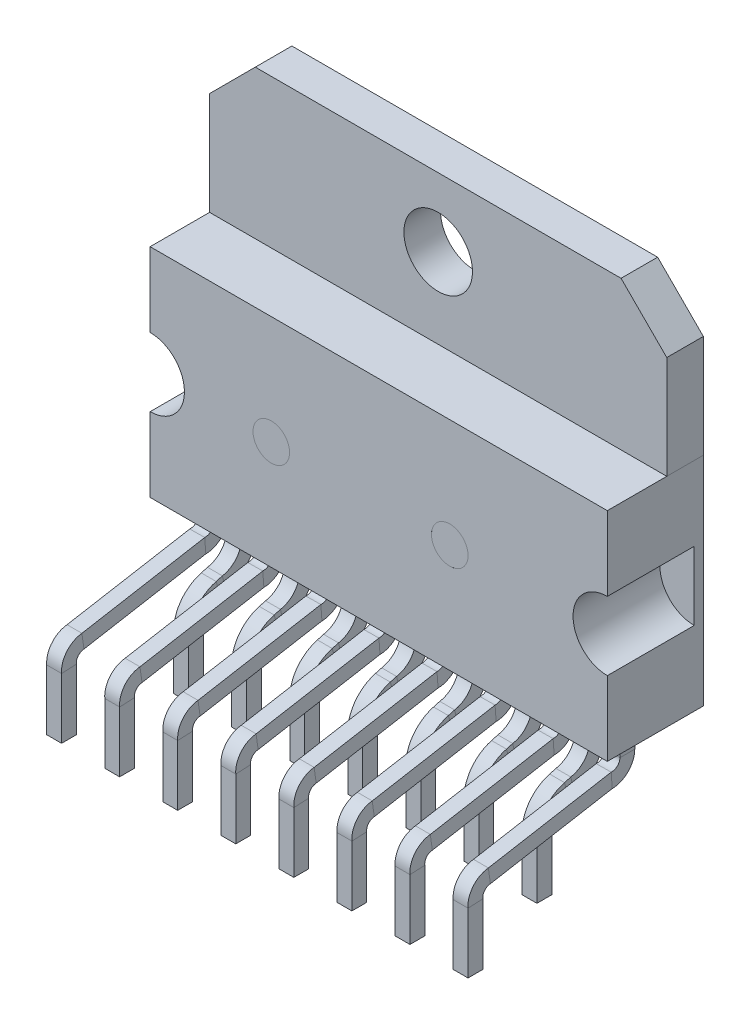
SolidWorks part; units mm, degrees
ref_plane "Front Plane" through (0, 0, 0) normal (0, 0, 1) x (1, 0, 0)
ref_plane "Top Plane" through (0, 0, 0) normal (0, 1, 0) x (1, 0, 0)
ref_plane "Right Plane" through (0, 0, 0) normal (1, 0, 0) x (0, 0, -1)
sketch "Sketch2" plane through (0, 0, 0) normal (0, 0, 1) x (1, 0, 0)
  line L0 (-9.2035, 0) -> (10.7965, 0)
  line L1 (10.7965, 0) -> (10.7965, 4.5)
  line L2 (10.7965, 4.5) -> (8.7965, 6.5022)
  line L3 (8.7965, 6.5022) -> (-7.2035, 6.5022)
  line L4 (-7.2035, 6.5022) -> (-9.2035, 4.5)
  line L5 (-9.2035, 4.5) -> (-9.2035, 0)
  line L6 (-9.2035, 0) -> (-9.2035, -9.5)
  line L7 (-9.2035, -9.5) -> (10.7965, -9.5)
  line L8 (10.7965, -9.5) -> (10.7965, 0)
  circle A0 centre (0.7965, 3.5022) radius 1.5
  dimension "D7" = 3
  dimension "D8" = 3
  dimension "D1" = 20
  dimension "D2" = 4.5
  dimension "D3" = 4.5
  dimension "D4" = 16
  dimension "D5" = 2.83
  dimension "D6" = 2.83
  dimension "D9" = 9.5
extrude "Boss-Extrude1" add sketch "Sketch2" along normal blind 1.6 contours L4 L5 L0 L1 L2 L3 A0 | L7 L8 L0 L6
sketch "Sketch3" plane through (0, 0, 1.6) normal (0, 0, 1) x (1, 0, 0)
  line L0 (-9.2035, -9.5) -> (-9.2035, 0)
  line L1 (-9.2035, 4.5) -> (-9.2035, -9.5) construction
  line L2 (-9.2035, 0) -> (10.7965, 0)
  line L3 (10.7965, -9.5) -> (10.7965, 4.5) construction
  line L4 (10.7965, 0) -> (10.7965, -9.5)
  line L5 (10.7965, -9.5) -> (-9.2035, -9.5)
  dimension "D1" = 9.5
extrude "Boss-Extrude3" add sketch "Sketch3" along normal blind 2.6
ref_plane "Plane2" through (-8.5335, 0, 0) normal (-1, 0, 0) x (0, 0, 1)
sketch "Sketch5" plane through (-8.5335, 0, 0) normal (-1, 0, 0) x (0, 0, 1)
  line L0 (2.1, -9.5) -> (2.1, -10.86)
  line L1 (4.2, -9.5) -> (0, -9.5) construction
  line L2 (2.7864, -11.54) -> (8.1344, -12.48)
  line L3 (8.7448, -13.2231) -> (8.7448, -14.5831)
  arc A0 (2.1, -10.86) -> (2.7864, -11.54) centre (2.78, -10.86) ccw
  arc A1 (8.1344, -12.48) -> (8.7448, -13.2231) centre (8.0681, -13.1567) cw
  dimension "D2" = 0.68
  dimension "D5" = 0.68
  dimension "D1" = 1.36
  dimension "D3" = 5.43
  dimension "D4" = 0.94
  dimension "D6" = 1.36
ref_plane "Plane3" through (0, -14.5831, 0) normal (0, 1, 0) x (1, 0, 0)
sketch "Sketch6" plane through (0, -14.5831, 0) normal (0, 1, 0) x (1, 0, 0)
  line L1 (-8.8585, -8.4198) -> (-8.2085, -8.4198)
  line L2 (-8.8585, -8.4198) -> (-8.8585, -9.0698)
  line L3 (-8.8585, -9.0698) -> (-8.2085, -9.0698)
  line L4 (-8.2085, -8.4198) -> (-8.2085, -9.0698)
  line L5 (-8.8585, -8.4198) -> (-8.2085, -9.0698) construction
  line L6 (-8.8585, -9.0698) -> (-8.2085, -8.4198) construction
  point P0 (-8.5335, -8.7448)
  dimension "D1" = 0.65
  dimension "D2" = 0.65
sweep "Sweep1" add profiles "Sketch6" path "Sketch5"
pattern_linear "LPattern1" count 8 spacing 2.54 along (1, 0, 0) of "Sweep1"
ref_plane "Plane4" through (-7.3085, 0, 0) normal (1, 0, 0) x (0, 0, -1)
sketch "Sketch8" plane through (-7.3085, 0, 0) normal (1, 0, 0) x (0, 0, -1)
  line L0 (-2.1, -9.5) -> (-2.1, -10.84)
  line L1 (-1.775, -9.5) -> (-2.425, -9.5) construction
  line L2 (-3.1865, -12.1475) -> (-3.4466, -12.2198)
  line L3 (-4.4155, -13.6166) -> (-4.4155, -15.8766)
  arc A0 (-2.1, -10.84) -> (-3.1865, -12.1475) centre (-3.43, -10.84) cw
  arc A1 (-3.4466, -12.2198) -> (-4.4155, -13.6166) centre (-3.0906, -13.5012) ccw
  dimension "D2" = 1.33
  dimension "D4" = 1.33
  dimension "D1" = 1.34
  dimension "D3" = 0.27
  dimension "D5" = 2.26
  dimension "D6" = 1.7
  dimension "D7" = 1.7
ref_plane "Plane5" through (0, -15.8766, 0) normal (0, -1, 0) x (-1, 0, 0)
sketch "Sketch9" plane through (0, -15.8766, 0) normal (0, -1, 0) x (-1, 0, 0)
  line L1 (6.9835, -4.7405) -> (7.6335, -4.7405)
  line L2 (6.9835, -4.7405) -> (6.9835, -4.0905)
  line L3 (6.9835, -4.0905) -> (7.6335, -4.0905)
  line L4 (7.6335, -4.7405) -> (7.6335, -4.0905)
  line L5 (6.9835, -4.7405) -> (7.6335, -4.0905) construction
  line L6 (6.9835, -4.0905) -> (7.6335, -4.7405) construction
  point P0 (7.3085, -4.4155)
  dimension "D1" = 0.65
  dimension "D2" = 0.65
sweep "Sweep3" add profiles "Sketch9" path "Sketch8"
pattern_linear "LPattern3" count 7 spacing 2.54 along (1, 0, 0) of "Sweep3"
sketch "Sketch10" plane through (0, 0, 4.2) normal (0, 0, 1) x (1, 0, 0)
  line L0 (-9.2035, 0) -> (-9.2035, -9.5) construction
  line L1 (0, 0) -> (0, -7.4418) construction
  line L2 (10.7965, -9.5) -> (10.7965, 0) construction
  line L3 (-9.2035, -3.25) -> (-9.2035, -6.25)
  line L4 (10.7965, -3.25) -> (10.7965, -6.25)
  arc A0 (-9.2035, -3.25) -> (-9.2035, -6.25) centre (-9.2035, -4.75) cw
  arc A2 (10.7965, -3.25) -> (10.7965, -6.25) centre (10.7965, -4.75) ccw
  dimension "D1" = 1.5
extrude "Cut-Extrude1" cut sketch "Sketch10" against normal blind 3.8
sketch "Sketch11" plane through (0, 0, 4.2) normal (0, 0, 1) x (1, 0, 0)
  line L0 (-7.7035, -4.75) -> (-3.9035, -4.75) construction
  line L1 (0, 0) -> (0, -6.4262) construction
  arc A0 (-9.2035, -6.25) -> (-9.2035, -3.25) centre (-9.2035, -4.75) ccw construction
  circle A1 centre (-3.9035, -4.75) radius 0.8
  circle A2 centre (3.9035, -4.75) radius 0.8
  dimension "D2" = 1.6
  dimension "D1" = 3.8
extrude "Cut-Extrude2" cut sketch "Sketch11" against normal blind 0.0001
sketch "Sketch16" plane through (10.7965, 0, 0) normal (1, 0, 0) x (0, 0, -1)
  line L0 (-1.6, 4.5) -> (0, 4.5)
  line L1 (0, 4.5) -> (0, 0)
  line L2 (0, 0) -> (-1.6, 0)
  line L3 (-1.6, 0) -> (-1.6, 4.5)
extrude "Boss-Extrude6" add sketch "Sketch16" along normal blind 0.0001
sketch "Sketch17" plane through (-9.2035, 0, 0) normal (-1, 0, 0) x (0, 0, 1)
  line L0 (0, 4.5) -> (1.6, 4.5)
  line L1 (1.6, 4.5) -> (1.6, 0)
  line L2 (1.6, 0) -> (0, 0)
  line L3 (0, 0) -> (0, 4.5)
extrude "Boss-Extrude7" add sketch "Sketch17" along normal blind 0.0001
sketch "Sketch18" plane through (0, -14.5831, 0) normal (0, -1, 0) x (-1, 0, 0)
  line L0 (6.3185, -8.4198) -> (6.3185, -9.0698)
  line L1 (8.8585, -8.4198) -> (8.2085, -8.4198)
  line L2 (8.8585, -8.4198) -> (8.8585, -9.0698)
  line L3 (8.8585, -9.0698) -> (8.2085, -9.0698)
  line L4 (8.2085, -8.4198) -> (8.2085, -9.0698)
  line L5 (6.3185, -8.4198) -> (5.6685, -8.4198)
  line L6 (5.6685, -8.4198) -> (5.6685, -9.0698)
  line L7 (6.3185, -9.0698) -> (5.6685, -9.0698)
  line L8 (3.7785, -8.4198) -> (3.7785, -9.0698)
  line L9 (3.7785, -8.4198) -> (3.1285, -8.4198)
  line L10 (3.1285, -8.4198) -> (3.1285, -9.0698)
  line L11 (3.7785, -9.0698) -> (3.1285, -9.0698)
  line L12 (1.2385, -8.4198) -> (1.2385, -9.0698)
  line L13 (1.2385, -8.4198) -> (0.5885, -8.4198)
  line L14 (0.5885, -8.4198) -> (0.5885, -9.0698)
  line L15 (1.2385, -9.0698) -> (0.5885, -9.0698)
  line L16 (-1.3015, -8.4198) -> (-1.3015, -9.0698)
  line L17 (-1.3015, -8.4198) -> (-1.9515, -8.4198)
  line L18 (-1.9515, -8.4198) -> (-1.9515, -9.0698)
  line L19 (-1.3015, -9.0698) -> (-1.9515, -9.0698)
  line L20 (-3.8415, -8.4198) -> (-3.8415, -9.0698)
  line L21 (-3.8415, -8.4198) -> (-4.4915, -8.4198)
  line L22 (-4.4915, -8.4198) -> (-4.4915, -9.0698)
  line L23 (-3.8415, -9.0698) -> (-4.4915, -9.0698)
  line L24 (-6.3815, -8.4198) -> (-6.3815, -9.0698)
  line L25 (-6.3815, -8.4198) -> (-7.0315, -8.4198)
  line L26 (-7.0315, -8.4198) -> (-7.0315, -9.0698)
  line L27 (-6.3815, -9.0698) -> (-7.0315, -9.0698)
  line L28 (-8.9215, -8.4198) -> (-8.9215, -9.0698)
  line L29 (-8.9215, -8.4198) -> (-9.5715, -8.4198)
  line L30 (-9.5715, -8.4198) -> (-9.5715, -9.0698)
  line L31 (-8.9215, -9.0698) -> (-9.5715, -9.0698)
  dimension "D1" = 8
extrude "Boss-Extrude9" add sketch "Sketch18" along normal blind 1.3
